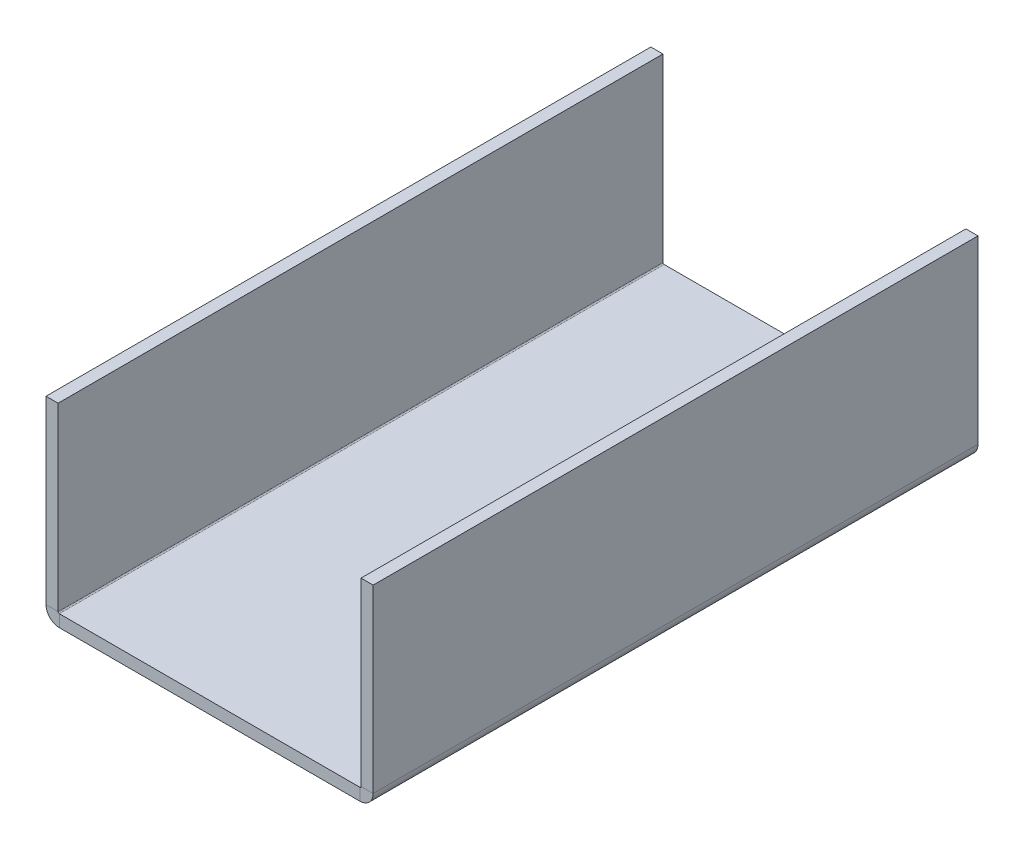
SolidWorks part; units mm, degrees
ref_plane "Front Plane" through (0, 0, 0) normal (0, 0, 1) x (1, 0, 0)
ref_plane "Top Plane" through (0, 0, 0) normal (0, 1, 0) x (1, 0, 0)
ref_plane "Right Plane" through (0, 0, 0) normal (1, 0, 0) x (0, 0, -1)
sketch "Sketch1" plane through (0, 0, 0) normal (0, 1, 0) x (1, 0, 0)
  line L1 (0, 0) -> (55, 0)
  line L2 (0, 0) -> (0, 50)
  line L3 (0, 50) -> (55, 50)
  line L4 (55, 0) -> (55, 50)
  dimension "D1" = 55
  dimension "D2" = 50
sheet metal parameters "Sheet-Metal1" thickness 1 parameters "D1"=0.1
base flange "Base-Flange1" sketch "Sketch1" thickness 1 reverse thickness direction yes parameters "D1"=0.1
sketch "Sketch3" plane through (0, 1, 0) normal (0, 1, 0) x (1, 0, 0)
  line L0 (15, 0) -> (15, 50)
  line L1 (0, 0) -> (55, 0) construction
  line L2 (55, 50) -> (0, 50) construction
  line L3 (40, 0) -> (40, 50)
  line L4 (55, 0) -> (55, 50) construction
  line L5 (0, 50) -> (0, 0) construction
  dimension "D1" = 15
  dimension "D2" = 15
sketched bend "Sketched Bend1" parameters "D1"=0.1
bend "SketchBend1" bend radius 0.1 bend angle 90 parameters "D5"=1
bend "SketchBend2" bend radius 0 bend angle 90 parameters "D5"=2
flat pattern "Flat-Pattern1"
sketch "Bend-Lines1" plane through (0, 0, 0) normal (0, 1, 0) x (-1, 0, 0)
bend of the flat pattern "Flatten-<SketchBend1>1"
bend of the flat pattern "Flatten-<SketchBend2>1"
